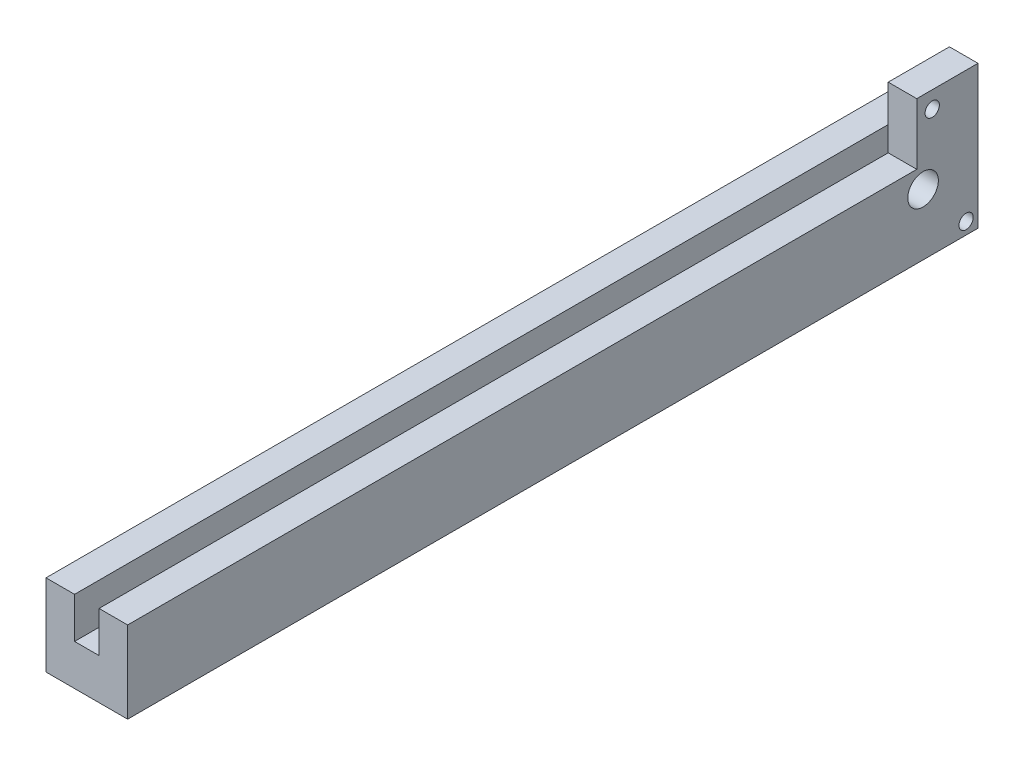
SolidWorks part; units mm, degrees
ref_plane "Front Plane" through (0, 0, 0) normal (0, 0, 1) x (1, 0, 0)
ref_plane "Top Plane" through (0, 0, 0) normal (0, 1, 0) x (1, 0, 0)
ref_plane "Right Plane" through (0, 0, 0) normal (1, 0, 0) x (0, 0, -1)
sketch "Sketch1" plane through (0, 0, 0) normal (0, 0, 1) x (1, 0, 0)
  line L1 (-12, 12) -> (12, 12)
  line L2 (-12, 12) -> (-12, -12)
  line L3 (-12, -12) -> (12, -12)
  line L4 (12, 12) -> (12, -12)
  line L5 (-12, 12) -> (12, -12) construction
  line L6 (-12, -12) -> (12, 12) construction
  point P0 (0, 0)
extrude "Boss-Extrude1" add sketch "Sketch1" along normal blind 250
sketch "Sketch2" plane through (0, 0, 250) normal (0, 0, 1) x (1, 0, 0)
  line L0 (12, 12) -> (-12, 12) construction
  line L1 (0, 0) -> (3.6, 0)
  line L2 (0, 0) -> (0, 12)
  line L3 (0, 12) -> (3.6, 12)
  line L4 (3.6, 0) -> (3.6, 12)
extrude "Cut-Extrude1" cut sketch "Sketch2" against normal up to surface (250 mm away)
mirror "Mirror1" about plane through (0, 0, 0) normal (1, 0, 0) of "Cut-Extrude1"
sketch "Sketch8" plane through (0, 12, 0) normal (0, 1, 0) x (1, 0, 0)
  line L0 (12, -250) -> (12, 0) construction
  line L1 (3.6, 0) -> (12, 0)
  line L2 (3.6, 0) -> (3.6, -18)
  line L3 (3.6, -18) -> (12, -18)
  line L4 (12, 0) -> (12, -18)
extrude "Boss-Extrude2" add sketch "Sketch8" along normal blind 18
sketch "Sketch6" plane through (12, 0, 0) normal (1, 0, 0) x (0, 0, -1)
  line L1 (-250, 12) -> (-18, 12) construction
  line L3 (-250, -12) -> (0, -12) construction
  line L4 (0, -12) -> (0, 30) construction
  circle A0 centre (-3.5, -8.5) radius 2.1
  circle A1 centre (-16.1491, 6) radius 4.5
  circle A2 centre (-13.4597, 25.053) radius 2.1
extrude "Cut-Extrude3" cut sketch "Sketch6" against normal up to surface (8.4 mm away)
equation "\"rail width\"= 24"
equation "\"system width\"= 125"
equation "\"system depth\"= 250"
equation "\"internal height\"= 100"
equation "\"carriage height\"= 24"
equation "\"belt width\"= 6"
equation "\"worm gear diameter\"= 8"
equation "\"D1@Sketch1\"=\"rail width\""
equation "\"D2@Sketch1\"=\"rail width\""
equation "\"D1@Boss-Extrude1\"=\"system depth\""
equation "\"D1@Sketch2\"= \"belt width\" * 0.6"
equation "\"motor mounting hole spacing\" = 35"
equation "\"motor hole radius\"= 4.2"
equation "\"motor diameter\"= 28"
equation "\"rotor shelf diameter\"= 9"
equation "\"rotor centre from motor centre\"= 8"
equation "\"pin radius\"= 2.7"
equation "\"pin spacing\"= 9"
equation "\"D1@Sketch6\"=\"motor hole radius\""
equation "\"D2@Sketch6\"=\"motor hole radius\""
equation "\"D5@Sketch6\"=sqr(17.5^2+8^2)"
equation "\"D6@Sketch6\"=sqr(17.5^2+8^2)"
equation "\"D7@Sketch6\"=\"rotor shelf diameter\""
equation "\"D4@Sketch6\"=6"
equation "\"D1@Sketch8\"=18"
equation "\"D1@Boss-Extrude2\"=18"
